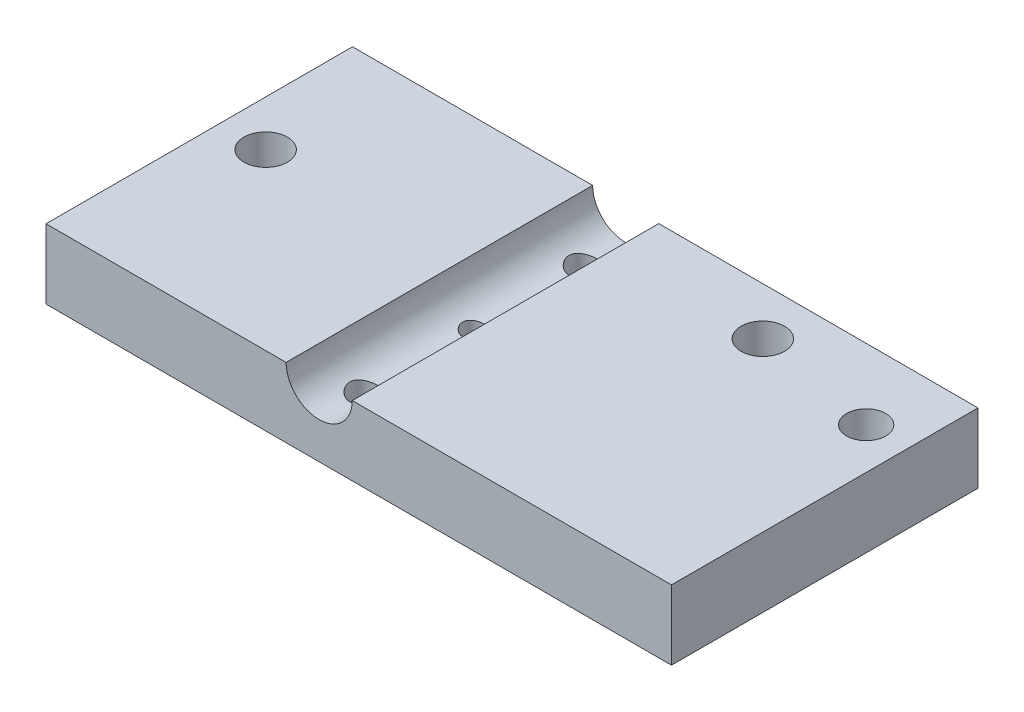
SolidWorks part; units mm, degrees
ref_plane "Front Plane" through (0, 0, 0) normal (0, 0, 1) x (1, 0, 0)
ref_plane "Top Plane" through (0, 0, 0) normal (0, 1, 0) x (1, 0, 0)
ref_plane "Right Plane" through (0, 0, 0) normal (1, 0, 0) x (0, 0, -1)
sketch "Sketch1" plane through (0, 0, 0) normal (0, 0, 1) x (1, 0, 0)
  line L1 (-71.9, 8) -> (71.9, 8)
  line L2 (-71.9, 8) -> (-71.9, -8)
  line L3 (-71.9, -8) -> (71.9, -8)
  line L4 (71.9, 8) -> (71.9, -8)
  line L5 (-71.9, 8) -> (71.9, -8) construction
  line L6 (-71.9, -8) -> (71.9, 8) construction
  point P0 (0, 0)
  dimension "D1" = 16
  dimension "D2" = 143.8
extrude "Boss-Extrude1" add sketch "Sketch1" along normal blind 70.47
sketch "Sketch2" plane through (0, -8, 0) normal (0, -1, 0) x (1, 0, 0)
  line L2 (-71.9, 70.47) -> (71.9, 70.47) construction
  line L3 (71.9, 70.47) -> (71.9, 0) construction
  circle A0 centre (-9.1, 60.17) radius 3.25
  circle A1 centre (-9.1, 9.77) radius 3.25
  dimension "D2" = 6.5
  dimension "D4" = 6.5
  dimension "D1" = 10.3
  dimension "D3" = 81
  dimension "D5" = 60.7
extrude "Cut-Extrude1" cut sketch "Sketch2" against normal through all
sketch "Sketch4" plane through (0, 0, 70.47) normal (0, 0, 1) x (1, 0, 0)
  line L0 (-9.1, 8) -> (-9.1, -8) construction
  line L1 (71.9, 8) -> (-71.9, 8) construction
  circle A0 centre (-9.1, 8) radius 7.6
  dimension "D1" = 15.2
extrude "Cut-Extrude2" cut sketch "Sketch4" against normal through all
sketch "Sketch5" plane through (0, 8, 0) normal (0, 1, 0) x (1, 0, 0)
  line L0 (-16.7, -70.47) -> (-71.9, -70.47) construction
  line L1 (-9.1, 0) -> (-9.1, -70.47) construction
  circle A0 centre (-9.1, -34.97) radius 2.5
  dimension "D1" = 5
  dimension "D2" = 35.5
  dimension "D3" = 25.2
  dimension "D4" = 25.2
extrude "Cut-Extrude3" cut sketch "Sketch5" against normal through all
sketch "Sketch6" plane through (0, 8, 0) normal (0, 1, 0) x (1, 0, 0)
  line L2 (71.9, 0) -> (-1.5, 0) construction
  line L3 (71.9, -70.47) -> (71.9, 0) construction
  circle A0 centre (62.4, -16.21) radius 4.5
  dimension "D2" = 9
  dimension "D1" = 16.21
  dimension "D3" = 9.5
extrude "Cut-Extrude4" cut sketch "Sketch6" against normal through all draft 2.27
sketch "Sketch7" plane through (0, 8, 0) normal (0, 1, 0) x (1, 0, 0)
  line L0 (-16.7, -70.47) -> (-71.9, -70.47) construction
  line L1 (-71.9, -70.47) -> (-71.9, 0) construction
  circle A0 centre (-61.4, -30.47) radius 5
  dimension "D1" = 10
  dimension "D2" = 40
  dimension "D3" = 10.5
extrude "Cut-Extrude5" cut sketch "Sketch7" against normal through all
sketch "Sketch8" plane through (0, 8, 0) normal (0, 1, 0) x (1, 0, 0)
  line L0 (71.9, -70.47) -> (71.9, 0) construction
  circle A0 centre (33.4, -10.97) radius 5
  dimension "D1" = 10
  dimension "D2" = 19.5
  dimension "D3" = 38.5
extrude "Cut-Extrude6" cut sketch "Sketch8" against normal through all
